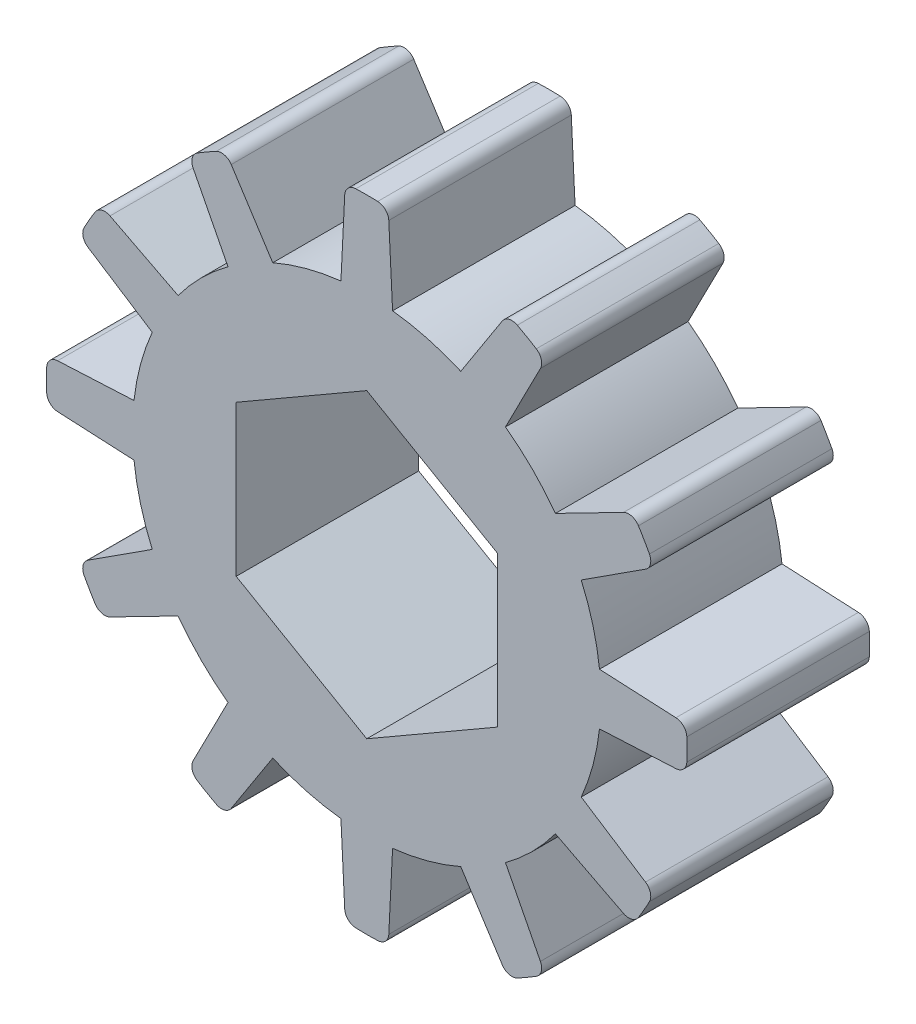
SolidWorks part; units mm, degrees
ref_plane "Alzado" through (0, 0, 0) normal (0, 0, 1) x (1, 0, 0)
ref_plane "Planta" through (0, 0, 0) normal (0, 1, 0) x (1, 0, 0)
ref_plane "Vista lateral" through (0, 0, 0) normal (1, 0, 0) x (0, 0, -1)
sketch "Croquis1" plane through (0, 0, 0) normal (0, 0, 1) x (1, 0, 0)
  line L0 (0, 0) -> (0, 4.6049) construction
  line L1 (0.375, 5.5679) -> (0.45, 4.0556)
  line L2 (-0.375, 5.5679) -> (-0.45, 4.0556)
  line L3 (2.4592, 5.0094) -> (1.6381, 3.7373)
  line L4 (3.1087, 4.6344) -> (2.4175, 3.2873)
  line L5 (4.6344, 3.1087) -> (3.2873, 2.4175)
  line L6 (5.0094, 2.4592) -> (3.7373, 1.6381)
  line L7 (5.5679, 0.375) -> (4.0556, 0.45)
  line L8 (5.5679, -0.375) -> (4.0556, -0.45)
  line L9 (5.0094, -2.4592) -> (3.7373, -1.6381)
  line L10 (4.6344, -3.1087) -> (3.2873, -2.4175)
  line L11 (3.1087, -4.6344) -> (2.4175, -3.2873)
  line L12 (2.4592, -5.0094) -> (1.6381, -3.7373)
  line L13 (0.375, -5.5679) -> (0.45, -4.0556)
  line L14 (-0.375, -5.5679) -> (-0.45, -4.0556)
  line L15 (-2.4592, -5.0094) -> (-1.6381, -3.7373)
  line L16 (-3.1087, -4.6344) -> (-2.4175, -3.2873)
  line L17 (-4.6344, -3.1087) -> (-3.2873, -2.4175)
  line L18 (-5.0094, -2.4592) -> (-3.7373, -1.6381)
  line L19 (-5.5679, -0.375) -> (-4.0556, -0.45)
  line L20 (-5.5679, 0.375) -> (-4.0556, 0.45)
  line L21 (-5.0094, 2.4592) -> (-3.7373, 1.6381)
  line L22 (-4.6344, 3.1087) -> (-3.2873, 2.4175)
  line L23 (-3.1087, 4.6344) -> (-2.4175, 3.2873)
  line L24 (-2.4592, 5.0094) -> (-1.6381, 3.7373)
  circle A0 centre (0, 0) radius 0.5
  arc A1 (1.6381, 3.7373) -> (0.45, 4.0556) centre (0, 0) ccw
  arc A2 (3.1087, 4.6344) -> (2.4592, 5.0094) centre (0, 0) ccw
  arc A3 (5.0094, 2.4592) -> (4.6344, 3.1087) centre (0, 0) ccw
  arc A4 (5.5679, -0.375) -> (5.5679, 0.375) centre (0, 0) ccw
  arc A5 (4.6344, -3.1087) -> (5.0094, -2.4592) centre (0, 0) ccw
  arc A6 (2.4592, -5.0094) -> (3.1087, -4.6344) centre (0, 0) ccw
  arc A7 (-0.375, -5.5679) -> (0.375, -5.5679) centre (0, 0) ccw
  arc A8 (-3.1087, -4.6344) -> (-2.4592, -5.0094) centre (0, 0) ccw
  arc A9 (-5.0094, -2.4592) -> (-4.6344, -3.1087) centre (0, 0) ccw
  arc A10 (-5.5679, 0.375) -> (-5.5679, -0.375) centre (0, 0) ccw
  arc A11 (-4.6344, 3.1087) -> (-5.0094, 2.4592) centre (0, 0) ccw
  arc A12 (-2.4592, 5.0094) -> (-3.1087, 4.6344) centre (0, 0) ccw
  arc A13 (0.375, 5.5679) -> (-0.375, 5.5679) centre (0, 0) ccw
  arc A14 (3.2873, 2.4175) -> (2.4175, 3.2873) centre (0, 0) ccw
  arc A15 (4.0556, 0.45) -> (3.7373, 1.6381) centre (0, 0) ccw
  arc A16 (3.7373, -1.6381) -> (4.0556, -0.45) centre (0, 0) ccw
  arc A17 (2.4175, -3.2873) -> (3.2873, -2.4175) centre (0, 0) ccw
  arc A18 (0.45, -4.0556) -> (1.6381, -3.7373) centre (0, 0) ccw
  arc A19 (-1.6381, -3.7373) -> (-0.45, -4.0556) centre (0, 0) ccw
  arc A20 (-3.2873, -2.4175) -> (-2.4175, -3.2873) centre (0, 0) ccw
  arc A21 (-4.0556, -0.45) -> (-3.7373, -1.6381) centre (0, 0) ccw
  arc A22 (-3.7373, 1.6381) -> (-4.0556, 0.45) centre (0, 0) ccw
  arc A23 (-2.4175, 3.2873) -> (-3.2873, 2.4175) centre (0, 0) ccw
  arc A24 (-0.45, 4.0556) -> (-1.6381, 3.7373) centre (0, 0) ccw
  dimension "D1" = 0.9
  dimension "D2" = 1
  dimension "D4" = 1.5
  dimension "D3" = 0.75
  dimension "D6" = 1.23
  dimension "D5" = 12
extrude "Saliente-Extruir1" add sketch "Croquis1" along normal blind 3.18
sketch "Croquis10" plane through (0, 0, 0) normal (0, 0, -1) x (-1, 0, 0)
  line L1 (0, -2.6269) -> (2.275, -1.3135)
  line L2 (2.275, -1.3135) -> (2.275, 1.3135)
  line L3 (2.275, 1.3135) -> (0, 2.6269)
  line L4 (0, 2.6269) -> (-2.275, 1.3135)
  line L5 (-2.275, 1.3135) -> (-2.275, -1.3135)
  line L6 (-2.275, -1.3135) -> (0, -2.6269)
  circle A0 centre (0, 0) radius 2.275 construction
  dimension "D1" = 4.55
extrude "Cortar-Extruir3" cut sketch "Croquis10" against normal through all
fillet "Redondeo1" radius 0.2 24 edges at (5.5679, -0.375, 1.59) (-2.4592, -5.0094, 1.59) (-3.1087, -4.6344, 1.59) (0.375, -5.5679, 1.59) (-0.375, -5.5679, 1.59) (3.1087, -4.6344, 1.59) (2.4592, -5.0094, 1.59) (5.0094, -2.4592, 1.59) (4.6344, -3.1087, 1.59) (-4.6344, -3.1087, 1.59) (-5.0094, -2.4592, 1.59) (-5.5679, -0.375, 1.59) (-5.5679, 0.375, 1.59) (-5.0094, 2.4592, 1.59) (-4.6344, 3.1087, 1.59) (-3.1087, 4.6344, 1.59) (-2.4592, 5.0094, 1.59) (5.5679, 0.375, 1.59) (5.0094, 2.4592, 1.59) (4.6344, 3.1087, 1.59) (3.1087, 4.6344, 1.59) (2.4592, 5.0094, 1.59) (0.375, 5.5679, 1.59) (-0.375, 5.5679, 1.59)
